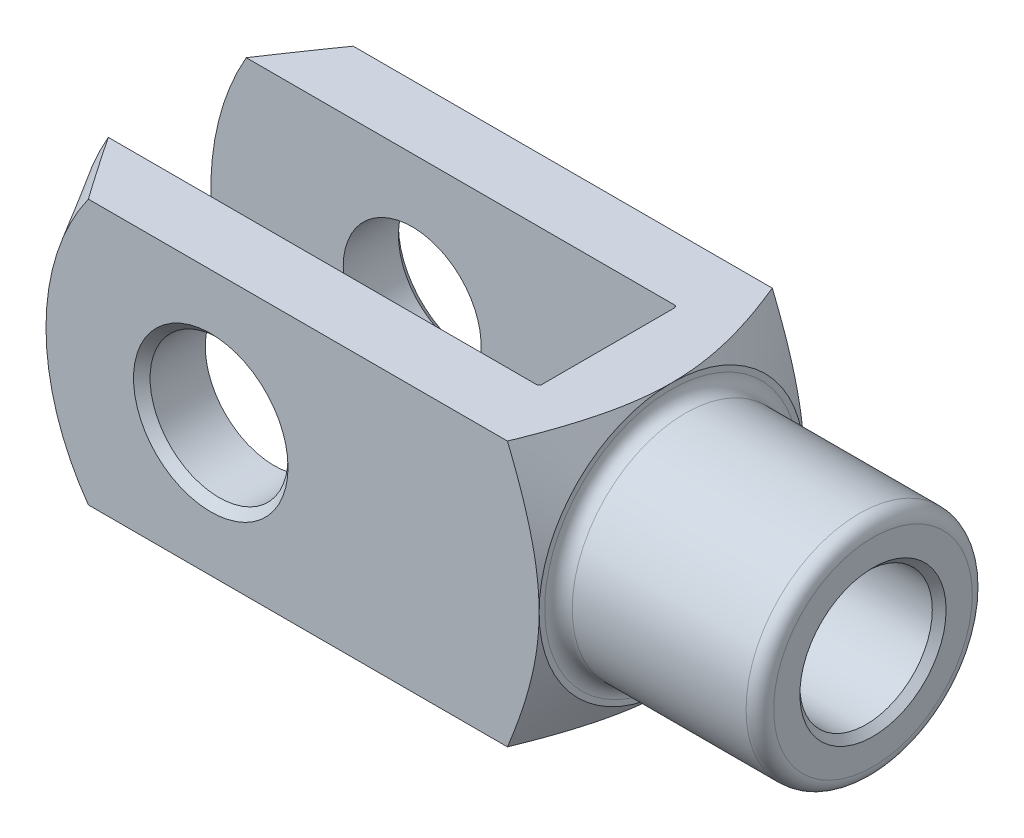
SolidWorks part; units mm, degrees
ref_plane "Front Plane" through (0, 0, 0) normal (0, 0, 1) x (1, 0, 0)
ref_plane "Top Plane" through (0, 0, 0) normal (0, 1, 0) x (1, 0, 0)
ref_plane "Right Plane" through (0, 0, 0) normal (1, 0, 0) x (0, 0, -1)
sketch "Sketch1" plane through (0, 0, 0) normal (1, 0, 0) x (0, 0, -1)
  line L0 (0, 0) -> (0, 50000) construction
  line L1 (0, 0) -> (50000, 0) construction
  line L2 (-48, -48) -> (-48, 48)
  line L3 (-48, 48) -> (48, 48)
  line L4 (48, -48) -> (48, 48)
  line L5 (-48, -48) -> (48, -48)
  point P9 (0, 48)
  point P11 (48, 0)
  point P12 (-48, 0)
  dimension "D1" = 96
  dimension "D2" = 96
extrude "Extrude1" add sketch "Sketch1" against normal blind 265
sketch "Sketch2" plane through (0, 0, 0) normal (1, 0, 0) x (0, 0, -1)
  circle A0 centre (0, 0) radius 41
  circle A1 centre (0, 0) radius 82
  dimension "D1" = 82
  dimension "D2" = 164
extrude "Extrude2" cut sketch "Sketch2" against normal blind 73
sketch "Sketch3" plane through (0, 0, 48) normal (0, 0, 1) x (1, 0, 0)
  circle A0 centre (-192, 0) radius 25
  dimension "D1" = 50
  dimension "D2" = 192
extrude "Extrude3" cut sketch "Sketch3" against normal through all
sketch "Sketch4" plane through (0, 48, 0) normal (0, 1, 0) x (1, 0, 0)
  line L0 (0, 0) -> (-50000, 0) construction
  line L1 (-265, -25) -> (-265, 25)
  line L2 (-265, 48) -> (-265, -48) construction
  line L3 (-265, 25) -> (-96, 25)
  line L4 (-96, 25) -> (-96, -25)
  line L5 (-192, 48) -> (-192, -48) construction
  line L6 (-265, -25) -> (-96, -25)
  point P7 (-192, 0)
  point P13 (-96, 0)
  point P14 (-265, 0)
  dimension "D1" = 96
  dimension "D2" = 50
extrude "Extrude4" cut sketch "Sketch4" against normal through all
fillet "Fillet1" radius 1 2 edges at (-96, 0, 25) (-96, 0, -25)
fillet "Fillet2" radius 5 2 edges at (0, 0, -41) (-73, 0, -41)
chamfer "Chamfer2" distance 3 angle 45 2 edges at (-167, 0, -48) (-167, 0, 48)
sketch "Sketch6" plane through (0, 0, 0) normal (0, 0, 1) x (1, 0, 0)
  line L0 (-73, -48) -> (-73, -96)
  line L1 (-73, -96) -> (-100.7128, -96)
  line L2 (-100.7128, -96) -> (-73, -48)
  dimension "D1" = 30
  dimension "D2" = 96
revolve "Cut-Revolve1" cut sketch "Sketch6" angle 360 about axis through (-73, 0, 0) along (1, 0, 0)
sketch "Sketch7" plane through (0, 0, 0) normal (0, 1, 0) x (1, 0, 0)
  line L0 (-251.7209, -48) -> (-265, -25)
  line L1 (-265, 25) -> (-251.7209, 48)
  line L2 (-251.7209, 48) -> (-361, 48)
  line L3 (-265, 25) -> (-265, -25)
  line L4 (-361, 48) -> (-361, -48)
  line L5 (-361, -48) -> (-251.7209, -48)
  line L6 (-265, 48) -> (-84.479, 48) construction
  line L7 (-265, -48) -> (-84.479, -48) construction
  line L8 (-169, 0.6162) -> (-169, 50000.6162) construction
  dimension "D1" = 120
  dimension "D2" = 96
  dimension "D3" = 96
revolve "Cut-Revolve2" cut sketch "Sketch7" angle 180 about L8
sketch "Sketch8" plane through (0, 0, 0) normal (1, 0, 0) x (0, 0, -1)
  circle A0 centre (0, 0) radius 24
  dimension "D1" = 48
extrude "Extrude5" cut sketch "Sketch8" against normal through all
chamfer "Chamfer3" distance 2.5 angle 45 1 edges at (0, 0, -24)
equation "\"D2@Sketch1\" = \"D1@Sketch1\""
equation "\"D2@Sketch2\" = \"D1@Sketch2\"*2"
equation "\"D2@Sketch6\" = \"D1@Sketch1\""
equation "\"D2@Sketch7\" = \"D1@Sketch1\""
equation "\"D3@Sketch7\" = \"D1@Sketch1\""
